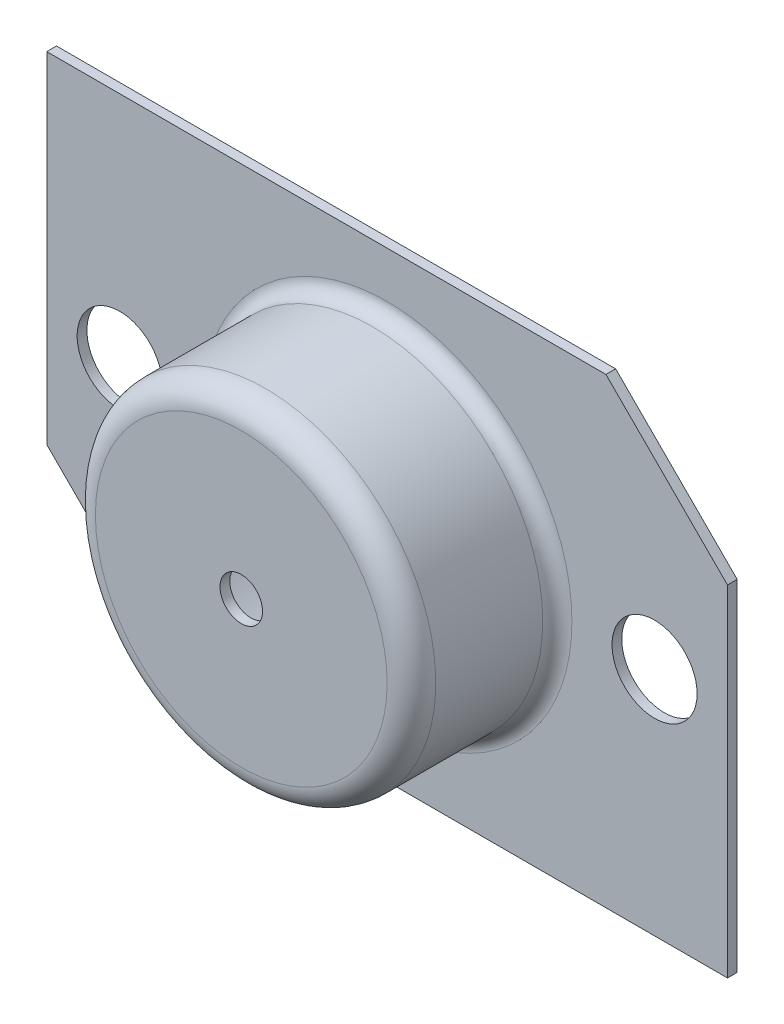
SolidWorks part; units mm, degrees
ref_plane "Plan1" through (0, 0, 0) normal (0, 0, 1) x (1, 0, 0)
ref_plane "Plan2" through (0, 0, 0) normal (0, 1, 0) x (1, 0, 0)
ref_plane "Plan3" through (0, 0, 0) normal (1, 0, 0) x (0, 0, -1)
sketch "Esquisse1" plane through (0, 0, 0) normal (0, 0, 1) x (1, 0, 0)
  line L0 (-50, -21) -> (6, -21) construction
  line L1 (6, -40) -> (-50, -40)
  line L2 (6, -40) -> (6, -2)
  line L3 (6, -2) -> (-50, -2)
  line L4 (-50, -40) -> (-50, -2)
  line L5 (-22, -2) -> (-22, -40) construction
  line L6 (-44, 10) -> (-44, -60) construction
  line L7 (0, 10) -> (0, -60) construction
  circle A0 centre (-22, -21) radius 13.2
  circle A1 centre (-44, -21) radius 3.5
  circle A2 centre (0, -21) radius 3.5
  dimension "D3" = 26.4
  dimension "D6" = 7
  dimension "D7" = 7
  dimension "D1" = 56
  dimension "D2" = 38
  dimension "D4" = 22
  dimension "D5" = 22
extrude "Base-Extrusion" add sketch "Esquisse1" along normal blind 0.8
chamfer "Chanfrein1" distance 10 angle 45 2 edges at (6, -2, 0.4) (-50, -40, 0.4)
ref_plane "Plan5" through (0, -21, 0) normal (0, -1, 0) x (1, 0, 0)
sketch "Esquisse2" plane through (0, -21, 0) normal (0, -1, 0) x (1, 0, 0)
  line L0 (-22, 0.8) -> (-22, 14.8973) construction
  line L1 (-8.8, 0.8) -> (-35.2, 0.8) construction
  line L2 (-23.75, 12.8) -> (-34, 12.8)
  line L3 (-36, 10.8) -> (-36, 0.8)
  line L4 (-4, 0.8) -> (-50, 0.8) construction
  line L5 (-23.75, 12) -> (-34, 12)
  line L6 (-35.2, 10.8) -> (-35.2, 0.8)
  line L7 (-36, 0.8) -> (-35.2, 0.8)
  line L8 (-23.75, 12.8) -> (-23.75, 12)
  line L9 (-36, 12.8) -> (-36, 0.8) construction
  line L10 (-23.75, 12.8) -> (-36, 12.8) construction
  line L11 (-35.2, 12) -> (-35.2, 0.8) construction
  line L12 (-23.75, 12) -> (-35.2, 12) construction
  arc A0 (-36, 10.8) -> (-34, 12.8) centre (-34, 10.8) cw
  arc A1 (-35.2, 10.8) -> (-34, 12) centre (-34, 10.8) cw
  dimension "D5" = 2
  dimension "D6" = 1.2
  dimension "D1" = 28
  dimension "D2" = 12
  dimension "D3" = 3.5
  dimension "D4" = 0.8
revolve "Révolution1" add sketch "Esquisse2" angle 360 about L0
fillet "Congé1" radius 1.2 1 edges at (-36, -21, 0.8)
fillet "Congé2" radius 2 1 edges at (-8.8, -21, 0)
